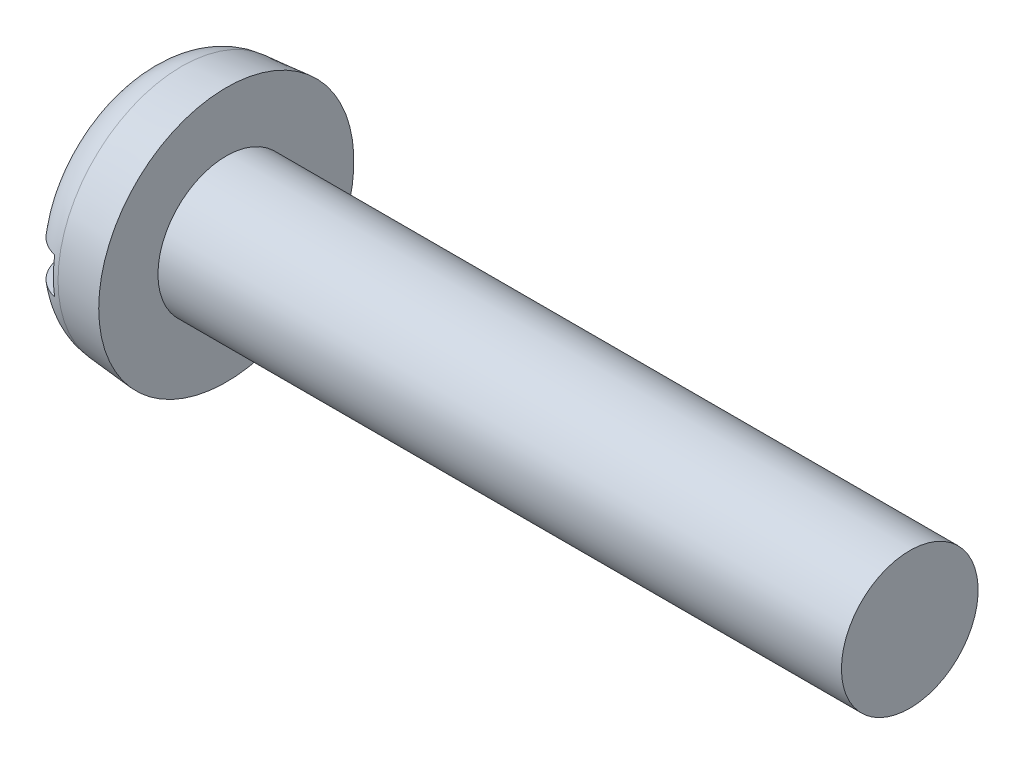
SolidWorks part; units mm, degrees
ref_plane "Plane1" through (0, 0, 0) normal (0, 0, 1) x (1, 0, 0)
ref_plane "Plane2" through (0, 0, 0) normal (0, 1, 0) x (1, 0, 0)
ref_plane "Plane3" through (0, 0, 0) normal (1, 0, 0) x (0, 0, -1)
sketch "BodySke" plane through (0, 0, 0) normal (0, 0, 1) x (1, 0, 0)
  line L0 (1.8, 1.5) -> (1.8, 2.8)
  line L1 (0, 0) -> (0, 2.6425)
  line L2 (-25.4, 0) -> (127, 0) construction
  line L3 (16.8, 0) -> (0, 0)
  line L4 (1.8, 1.5) -> (16.8, 1.5)
  line L5 (16.8, 1.5) -> (16.8, 0)
  line L6 (0, 2.6425) -> (1.8, 2.8)
  line L9 (2.3, 3.0875) -> (2.3, -6.4375) construction
  line L10 (1.8, 6.35) -> (1.8, -3.175) construction
  dimension "Head_ht" = 1.8
  dimension "Diameter" = 3
  dimension "Length" = 15
  dimension "Head_dia" = 5.6
  dimension "Advance" = 0.5
  dimension "Thread_nom" = 15
  dimension "Head_side_angle" = 5
revolve "Base-Revolve" add sketch "BodySke"
fillet "Fillet1" [suppressed] radius 0.1
fillet "Fillet2" radius 0.9 1 edges at (0, 0, 2.6425)
sketch "Sketch2" plane through (0, 0, 0) normal (1, 0, 0) x (0, 0, -1)
  line L0 (2.8, -0.4) -> (-2.8, -0.4)
  line L1 (2.8, -0.4) -> (2.8, 0.4)
  line L2 (-2.8, 0.4) -> (2.8, 0.4)
  line L3 (-2.8, 0.4) -> (-2.8, -0.4)
  dimension "D1" = 5.6
  dimension "D2" = 2.8
  dimension "Slot_width" = 0.8
  dimension "D3" = 0.4
extrude "Slot" cut sketch "Sketch2" along normal blind 0.7
sketch "ThdSchSke" plane through (0, 0, 0) normal (0, 0, 1) x (1, 0, 0)
  line L0 (2.8, -1.2195) -> (2.6036, -1.5)
  line L1 (2.8, -1.2195) -> (2.9964, -1.5)
  line L2 (2.9964, -1.5) -> (2.9964, -1.875)
  line L3 (-3.175, 0) -> (5.1513, 0) construction
  line L5 (2.9964, -1.875) -> (2.6036, -1.875)
  line L6 (2.6036, -1.875) -> (2.6036, -1.5)
  dimension "Thread_minor" = 2.439
  dimension "Diameter" = 3
  dimension "Start" = 2.8
  dimension "SideAngle" = 55
  dimension "VeeAngle" = 70
  dimension "Overcut" = 3.75
revolve "ThreadSchematic" [suppressed] cut sketch "ThdSchSke" angle 360 about L3
pattern_linear "ThdSchPat" [suppressed]
equation "\"D1@Sketch2\" = \"Head_dia@BodySke\""
equation "\"D2@Sketch2\" = \"D1@Sketch2\" / 2"
equation "\"D3@Sketch2\" = \"Slot_width@Sketch2\" / 2"
equation "\"Thread_length@ThreadCosmetic\" = ((sgn( (\"Length@BodySke\" - \"Advance@BodySke\" * 2.0 ) - \"Thread_nom@BodySke\" )-1)*( (\"Length@BodySke\" - \"Advance@BodySke\"  * 2.0) - \"Thread_nom@BodySke\" ))/-2+ \"Thread_"
equation "\"Thread_minor@ThdSchSke\" = \"Thread_minor@ThreadCosmetic\""
equation "\"Diameter@ThdSchSke\" = \"Diameter@BodySke\""
equation "\"Overcut@ThdSchSke\" = \"Diameter@BodySke\" * 1.25"
equation "\"Start@ThdSchSke\" = \"Head_ht@BodySke\" + \"Length@BodySke\" - \"Thread_length@ThreadCosmetic\"  '---Non-countersunk---"
equation "\"Num_threads@ThdSchPat\" = int( \"Thread_length@ThreadCosmetic\" / \"Advance@BodySke\" + 0.999 )  + 1"
equation "\"Advance@ThdSchPat\" = \"Thread_length@ThreadCosmetic\" /  (\"Num_threads@ThdSchPat\" - 1) 'relax it"
